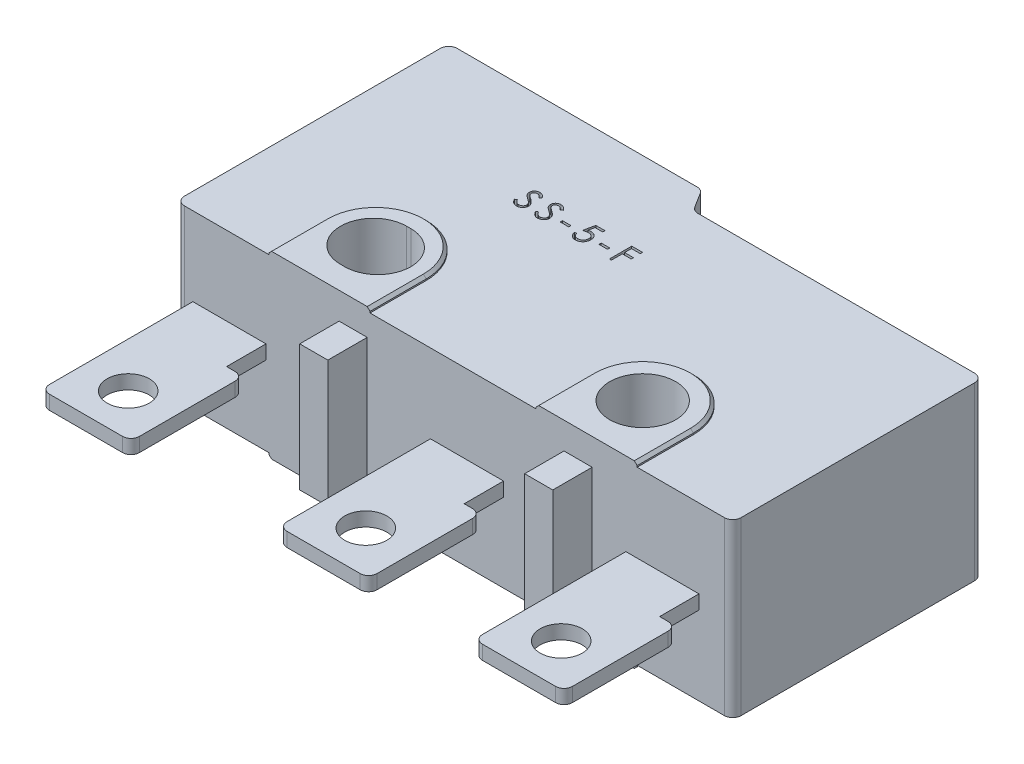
SolidWorks part; units mm, degrees
ref_plane "Front" through (0, 0, 0) normal (0, 0, 1) x (1, 0, 0)
ref_plane "Top" through (0, 0, 0) normal (0, 1, 0) x (1, 0, 0)
ref_plane "Right" through (0, 0, 0) normal (1, 0, 0) x (0, 0, -1)
sketch "Sketch1" plane through (0, 0, 0) normal (0, 1, 0) x (1, 0, 0)
  line L0 (19.5, 8.9) -> (9.6663, 8.9)
  line L1 (0.3, 0) -> (19.5, 0)
  line L2 (0, 0.3) -> (0, 9.4)
  line L3 (0.3, 9.7) -> (8.8337, 9.7)
  line L4 (19.8, 0.3) -> (19.8, 8.6)
  line L5 (9.4119, 9.041) -> (9.0881, 9.559)
  arc A0 (8.8337, 9.7) -> (9.0881, 9.559) centre (8.8337, 9.4) cw
  arc A1 (9.6663, 8.9) -> (9.4119, 9.041) centre (9.6663, 9.2) cw
  arc A2 (0, 9.4) -> (0.3, 9.7) centre (0.3, 9.4) cw
  arc A3 (0.3, 0) -> (0, 0.3) centre (0.3, 0.3) cw
  arc A4 (19.8, 0.3) -> (19.5, 0) centre (19.5, 0.3) cw
  arc A5 (19.5, 8.9) -> (19.8, 8.6) centre (19.5, 8.6) cw
  point P8 (9, 9.7)
  point P11 (9.5, 8.9)
  point P14 (0, 9.7)
  point P17 (0, 0)
  point P22 (19.8, 8.9)
  dimension "D6" = 0.3
  dimension "D1" = 19.8
  dimension "D2" = 9.7
  dimension "D3" = 8.9
  dimension "D4" = 9
  dimension "D5" = 9.5
extrude "Base-Extrude" add sketch "Sketch1" along normal blind 6.1
sketch "Sketch2" plane through (0, 6.1, 0) normal (0, 1, 0) x (-1, 0, 0)
  line L0 (-19.8, -4.45) -> (0, -4.45) construction
  line L1 (-19.8, -0.3) -> (-19.8, -8.6) construction
  line L2 (0, -9.4) -> (0, -0.3) construction
  line L3 (-9.9, -4.45) -> (-9.9, 2.6225) construction
  line L5 (-8.8337, -9.7) -> (-0.3, -9.7) construction
  line L6 (-5.025, -3.175) -> (-5.175, -3.175)
  line L7 (-5.1, -2.9248) -> (-5.1, -2.0231) construction
  line L8 (-5.025, -0.825) -> (-5.175, -0.825)
  arc A0 (-5.175, -3.175) -> (-5.175, -0.825) centre (-5.175, -2) cw
  circle A1 centre (-14.6, -2) radius 1.175
  arc A2 (-5.025, -3.175) -> (-5.025, -0.825) centre (-5.025, -2) ccw
  dimension "D1" = 2.35
  dimension "D2" = 2.5
  dimension "D3" = 7.7
  dimension "D4" = 9.5
  dimension "D5" = 5.1
extrude "Cut-Extrude1" cut sketch "Sketch2" against normal through all
sketch "Sketch3" plane through (0, 6.1, 0) normal (0, 1, 0) x (-1, 0, 0)
  line L0 (-0.3, 0) -> (-19.5, 0) construction
  line L1 (-3.3, 0) -> (-6.9, 0)
  line L2 (-12.8, -2) -> (-12.8, 0)
  line L3 (-16.4, 0) -> (-16.4, -2)
  line L4 (-6.9, 0) -> (-6.9, -2)
  line L5 (-3.3, 0) -> (-3.3, -2)
  line L6 (-12.8, 0) -> (-16.4, 0)
  line L7 (-5.175, -3.175) -> (-5.025, -3.175) construction
  line L8 (-5.025, -0.825) -> (-5.175, -0.825) construction
  line L9 (-5.175, -3.175) -> (-5.025, -3.175)
  line L10 (-5.025, -0.825) -> (-5.175, -0.825)
  line L11 (-5.1, -2.7811) -> (-5.1, -2.2281) construction
  arc A0 (-6.9, -2) -> (-3.3, -2) centre (-5.1, -2) ccw
  arc A1 (-16.4, -2) -> (-12.8, -2) centre (-14.6, -2) ccw
  circle A3 centre (-14.6, -2) radius 1.175 construction
  circle A4 centre (-14.6, -2) radius 1.175
  arc A5 (-5.025, -3.175) -> (-5.025, -0.825) centre (-5.025, -2) ccw construction
  arc A6 (-5.175, -0.825) -> (-5.175, -3.175) centre (-5.175, -2) ccw construction
  arc A7 (-5.025, -3.175) -> (-5.025, -0.825) centre (-5.025, -2) ccw
  arc A8 (-5.175, -0.825) -> (-5.175, -3.175) centre (-5.175, -2) ccw
  dimension "D1" = 3.6
extrude "Boss-Extrude1" add sketch "Sketch3" along normal blind 0.15
sketch "Sketch4" plane through (0, 0, 0) normal (0, -1, 0) x (1, 0, 0)
  line L0 (5.025, -0.825) -> (5.175, -0.825) construction
  line L1 (5.175, -3.175) -> (5.025, -3.175) construction
  line L2 (5.025, -0.825) -> (5.175, -0.825)
  line L3 (16.4, 0) -> (12.8, 0)
  line L4 (16.4, -2) -> (16.4, 0)
  line L5 (12.8, 0) -> (12.8, -2)
  line L6 (16.4, 0) -> (12.8, 0)
  line L7 (16.4, -2) -> (16.4, 0)
  line L8 (12.8, 0) -> (12.8, -2)
  line L9 (3.3, 0) -> (3.3, -2)
  line L10 (6.9, 0) -> (3.3, 0)
  line L11 (6.9, -2) -> (6.9, 0)
  line L12 (3.3, 0) -> (3.3, -2)
  line L13 (6.9, 0) -> (3.3, 0)
  line L14 (6.9, -2) -> (6.9, 0)
  line L15 (5.175, -3.175) -> (5.025, -3.175)
  circle A0 centre (14.6, -2) radius 1.175 construction
  arc A1 (12.8, -2) -> (16.4, -2) centre (14.6, -2) ccw
  arc A2 (12.8, -2) -> (16.4, -2) centre (14.6, -2) ccw
  arc A3 (3.3, -2) -> (6.9, -2) centre (5.1, -2) ccw
  arc A4 (3.3, -2) -> (6.9, -2) centre (5.1, -2) ccw
  circle A5 centre (14.6, -2) radius 1.175
  arc A7 (5.025, -0.825) -> (5.025, -3.175) centre (5.025, -2) ccw construction
  arc A8 (5.175, -3.175) -> (5.175, -0.825) centre (5.175, -2) ccw construction
  arc A9 (5.025, -0.825) -> (5.025, -3.175) centre (5.025, -2) ccw
  arc A10 (5.175, -3.175) -> (5.175, -0.825) centre (5.175, -2) ccw
  dimension "D1" = 0
  dimension "D2" = 0
extrude "Boss-Extrude2" add sketch "Sketch4" along normal blind 0.15
chamfer "Chamfer1" distance 0.1 angle 45 16 edges at (5.1, -0.15, -3.8) (6.9, -0.15, -1) (3.3, -0.15, -1) (3.3, 6.25, -1) (6.9, 6.25, -1) (5.1, 6.25, -3.8) (16.4, 6.25, -1) (14.6, 6.25, -3.8) (12.8, 6.25, -1) (12.8, -0.15, -1) (14.6, -0.15, -3.8) (16.4, -0.15, -1)
sketch "Sketch5" plane through (0, 0, -9.7) normal (0, 0, -1) x (-1, 0, 0)
  line L0 (-19.8, 3.05) -> (1.3211, 3.05) construction
  line L1 (-7.35, 1.35) -> (-6.65, 1.35)
  line L2 (-7.85, 1.85) -> (-7.85, 4.25)
  line L3 (-7.35, 4.75) -> (-6.65, 4.75)
  line L4 (-6.15, 1.85) -> (-6.15, 4.25)
  line L5 (-19.8, 6.1) -> (-19.8, 0) construction
  line L6 (-7, 4.75) -> (-7, -2.8261) construction
  line L8 (0, 6.1) -> (0, 0) construction
  arc A0 (-6.65, 1.35) -> (-6.15, 1.85) centre (-6.65, 1.85) ccw
  arc A1 (-7.35, 1.35) -> (-7.85, 1.85) centre (-7.35, 1.85) cw
  arc A2 (-7.85, 4.25) -> (-7.35, 4.75) centre (-7.35, 4.25) cw
  arc A3 (-6.15, 4.25) -> (-6.65, 4.75) centre (-6.65, 4.25) ccw
  dimension "D4" = 0.5
  dimension "D1" = 3.4
  dimension "D2" = 7
  dimension "D3" = 1.7
extrude "Boss-Extrude3" add sketch "Sketch5" along normal offset from surface (1.2 mm away) 10.9
fillet "Fillet1" radius 0.8 8 edges at (7, 1.35, -10.9) (6.2964, 1.4964, -10.9) (6.15, 3.05, -10.9) (6.2964, 4.6036, -10.9) (7, 4.75, -10.9) (7.7036, 4.6036, -10.9) (7.85, 3.05, -10.9) (7.7036, 1.4964, -10.9)
sketch "Sketch6" plane through (0, 0, 0) normal (0, 0, 1) x (1, 0, 0)
  line L0 (19.8, 3.05) -> (0, 3.05) construction
  line L1 (19.8, 6.1) -> (19.8, 0) construction
  line L2 (0, 6.1) -> (0, 0) construction
  line L3 (9.05, 3.3) -> (12.25, 3.3)
  line L4 (0.6, 3.3) -> (3.8, 3.3)
  line L5 (0.6, 3.3) -> (0.6, 2.8)
  line L6 (0.6, 2.8) -> (3.8, 2.8)
  line L7 (3.8, 3.3) -> (3.8, 2.8)
  line L8 (9.05, 3.3) -> (9.05, 2.8)
  line L9 (9.05, 2.8) -> (12.25, 2.8)
  line L10 (12.25, 3.3) -> (12.25, 2.8)
  line L16 (16, 3.3) -> (19.2, 3.3)
  line L17 (16, 3.3) -> (16, 2.8)
  line L18 (16, 2.8) -> (19.2, 2.8)
  line L19 (19.2, 3.3) -> (19.2, 2.8)
  dimension "D1" = 3.2
  dimension "D2" = 0.5
  dimension "D3" = 0.6
  dimension "D4" = 5.25
  dimension "D5" = 3.75
  dimension "D6" = 0.6
extrude "Boss-Extrude4" add sketch "Sketch6" along normal blind 5.4
ref_plane "Plane1" through (0, 3, 0) normal (0, 1, 0) x (-1, 0, 0)
sketch "Sketch12" plane through (-10.5764, 6.1, -1.0592) normal (0, 1, 0) x (1, 0, 0)
  text T0 "SS-5-F" font "Century Gothic" height in points 3
extrude "Cut-Extrude3" cut sketch "Sketch12" against normal blind 0.3
sketch "Sketch13" plane through (0, 6.25, 0) normal (0, 1, 0) x (-1, 0, 0)
  line L0 (-0.3, 0) -> (-3.3, 0) construction
  line L1 (-3.2, 0) -> (-3.8, 0)
  line L2 (-3.2, 0) -> (-3.2, 1.4)
  line L3 (-3.2, 1.4) -> (-3.8, 1.4)
  line L4 (-3.8, 0) -> (-3.8, 1.4)
  line L5 (-3.8, 5.4) -> (-3.8, 0) construction
  line L6 (-6.9, 0) -> (-12.8, 0) construction
  line L7 (-11.65, 0) -> (-12.25, 0)
  line L8 (-11.65, 0) -> (-11.65, 1.4)
  line L9 (-11.65, 1.4) -> (-12.25, 1.4)
  line L10 (-12.25, 0) -> (-12.25, 1.4)
  line L11 (-12.25, 5.4) -> (-12.25, 0) construction
  line L12 (-16.4, 0) -> (-19.5, 0) construction
  line L13 (-18.6, 0) -> (-19.2, 0)
  line L14 (-18.6, 0) -> (-18.6, 1.4)
  line L15 (-18.6, 1.4) -> (-19.2, 1.4)
  line L16 (-19.2, 0) -> (-19.2, 1.4)
  line L17 (-19.2, 5.4) -> (-19.2, 0) construction
  line L18 (-0.6, 5.4) -> (-0.6, 0) construction
  line L19 (-3.8, 5.4) -> (-0.6, 5.4) construction
  line L20 (-2.2, 1.5542) -> (-2.2, 7.1087) construction
  line L21 (-10.65, 1.8137) -> (-10.65, 6.7628) construction
  line L22 (-17.6, 1.8137) -> (-17.6, 7.7237) construction
  line L23 (-16, 5.4) -> (-16, 0) construction
  line L24 (-9.05, 5.4) -> (-9.05, 0) construction
  circle A0 centre (-2.2, 3.9) radius 0.75
  circle A1 centre (-10.65, 3.9) radius 0.75
  circle A2 centre (-17.6, 3.9) radius 0.75
  dimension "D3" = 1.5
  dimension "D4" = 1.5
  dimension "D1" = 2.6
  dimension "D2" = 4
extrude "Cut-Extrude4" cut sketch "Sketch13" against normal blind 10
sketch "Sketch14" plane through (0, 0, 0) normal (0, 0, 1) x (1, 0, 0)
  line L0 (0, 6.1) -> (0, 0) construction
  line L1 (5.8, 5.3) -> (6.8, 5.3)
  line L2 (5.8, 5.3) -> (5.8, 0.8)
  line L3 (5.8, 0.8) -> (6.8, 0.8)
  line L4 (6.8, 5.3) -> (6.8, 0.8)
  line L5 (13.8, 5.3) -> (14.8, 5.3)
  line L6 (13.8, 5.3) -> (13.8, 0.8)
  line L7 (13.8, 0.8) -> (14.8, 0.8)
  line L8 (14.8, 5.3) -> (14.8, 0.8)
  line L9 (4.4581, 3.05) -> (12.1103, 3.05) construction
  line L10 (6.9, 6.1) -> (12.8, 6.1) construction
  line L11 (6.9, 0) -> (12.8, 0) construction
  dimension "D1" = 1
  dimension "D2" = 5.8
  dimension "D3" = 7
  dimension "D4" = 4.5
extrude "Extrude1" add sketch "Sketch14" along normal blind 1.4
fillet "Fillet2" radius 0.3 9 edges at (19.2, 3.05, 1.4) (19.2, 3.05, 5.4) (12.25, 3.05, 5.4) (12.25, 3.05, 1.4) (16, 3.05, 5.4) (9.05, 3.05, 5.4) (0.6, 3.05, 5.4) (3.8, 3.05, 5.4) (3.8, 3.05, 1.4)
sketch "Sketch15" plane through (0, 6.25, 0) normal (0, 1, 0) x (1, 0, 0)
  line L0 (5.025, 0.825) -> (5.175, 0.825) construction
  line L1 (5.175, 3.175) -> (5.025, 3.175) construction
  circle A0 centre (5.1, 2) radius 1.175
